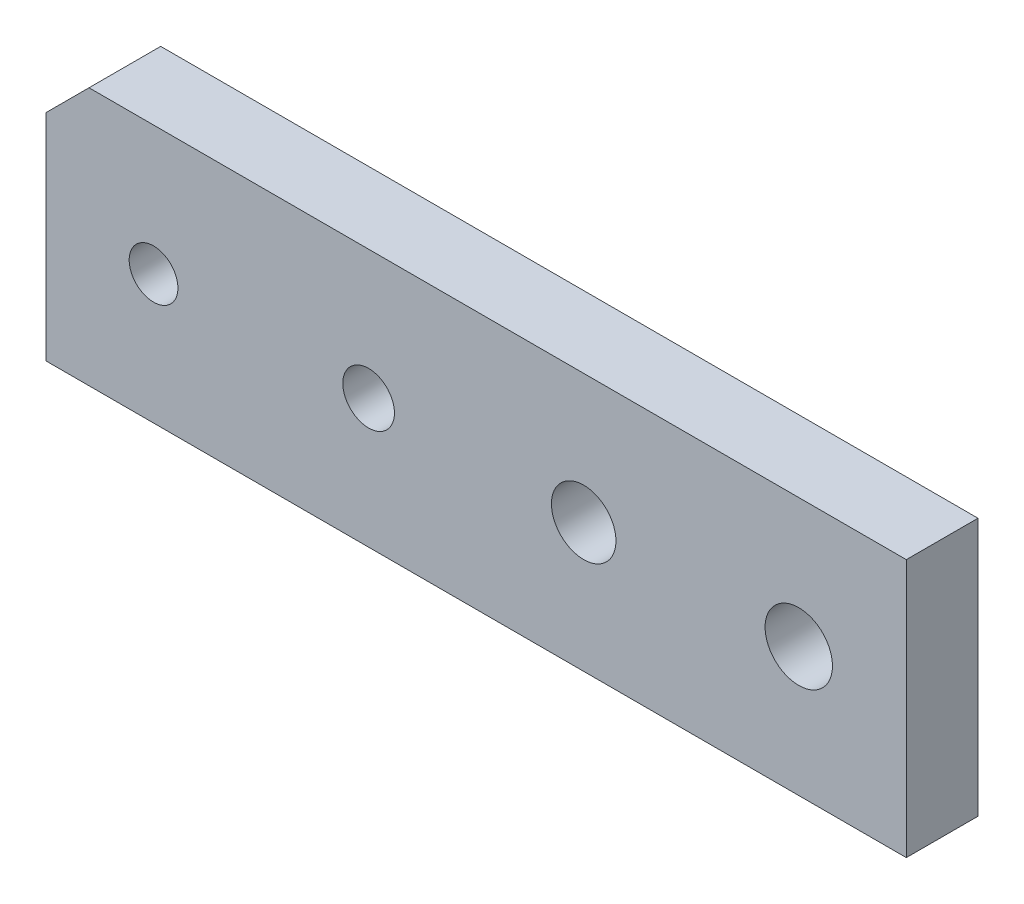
SolidWorks part; units mm, degrees
ref_plane "前视基准面" through (0, 0, 0) normal (0, 0, 1) x (1, 0, 0)
ref_plane "上视基准面" through (0, 0, 0) normal (0, 1, 0) x (1, 0, 0)
ref_plane "右视基准面" through (0, 0, 0) normal (1, 0, 0) x (0, 0, -1)
other "Configuration Table"
sketch "草图1" plane through (0, 0, 0) normal (0, 0, 1) x (1, 0, 0)
  line L0 (-30, -9) -> (30, -9)
  line L1 (30, -9) -> (30, 9)
  line L2 (30, 9) -> (-27, 9)
  line L3 (-27, 9) -> (-30, 6)
  line L4 (-30, 6) -> (-30, -9)
  circle A0 centre (-22.5, 0) radius 1.7
  circle A1 centre (-7.5, 0) radius 1.8
  circle A2 centre (7.5, 0) radius 2.25
  circle A3 centre (22.5, 0) radius 2.35
  dimension "D1" = 3.6
  dimension "D2" = 3.4
  dimension "D3" = 4.7
  dimension "D4" = 4.5
  dimension "D5" = 7.5
  dimension "D6" = 22.5
  dimension "D7" = 30
  dimension "D8" = 7.5
  dimension "D9" = 22.5
  dimension "D10" = 27
  dimension "D11" = 30
  dimension "D12" = 6
  dimension "D13" = 9
  dimension "D14" = 9
extrude "Four_clearance_trials" add sketch "草图1" along normal blind 5
